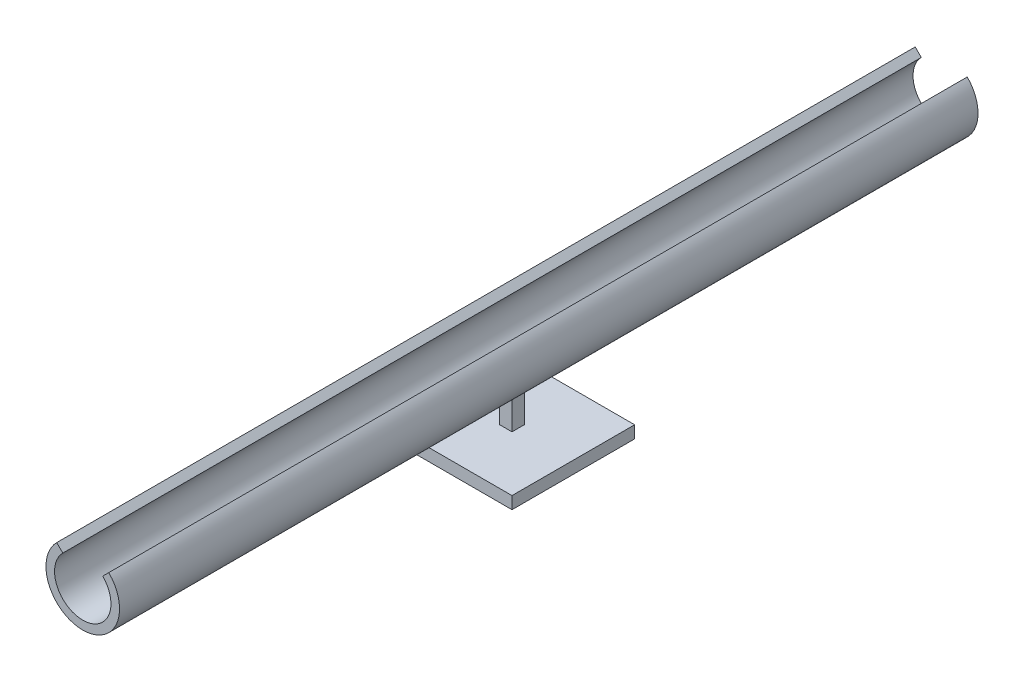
SolidWorks part; units mm, degrees
ref_plane "Plan de face" through (0, 0, 0) normal (0, 0, 1) x (1, 0, 0)
ref_plane "Plan de dessus" through (0, 0, 0) normal (0, 1, 0) x (1, 0, 0)
ref_plane "Plan de droite" through (0, 0, 0) normal (1, 0, 0) x (0, 0, -1)
sketch "Esquisse1" plane through (0, 0, 0) normal (0, 0, 1) x (1, 0, 0)
  line L0 (16.2635, 16.2635) -> (21.2132, 21.2132)
  line L1 (-16.2635, 16.2635) -> (-21.2132, 21.2132)
  line L2 (0, 0) -> (0, 79.2568) construction
  arc A0 (-16.2635, 16.2635) -> (16.2635, 16.2635) centre (0, 0) ccw
  arc A1 (-21.2132, 21.2132) -> (21.2132, 21.2132) centre (0, 0) ccw
  dimension "D1" = 23
  dimension "D2" = 30
extrude "Boss.-Extru.1" add sketch "Esquisse1" along normal mid plane 700
sketch "Esquisse2" plane through (0, 0, 0) normal (0, 0, 1) x (1, 0, 0)
  line L0 (0, 0) -> (0, -81.5006) construction
  line L1 (-5, -29.5804) -> (5, -29.5804)
  line L2 (-5, -29.5804) -> (-5, -60)
  line L3 (-5, -60) -> (5, -60)
  line L4 (5, -29.5804) -> (5, -60)
  arc A0 (-21.2132, 21.2132) -> (21.2132, 21.2132) centre (0, 0) ccw construction
  dimension "D1" = 10
  dimension "D2" = 60
extrude "Boss.-Extru.2" add sketch "Esquisse2" along normal mid plane 10
sketch "Esquisse3" plane through (0, 0, 0) normal (0, 0, 1) x (1, 0, 0)
  line L0 (-5, -60) -> (5, -60) construction
  line L1 (-50, -60) -> (50, -60)
  line L2 (-50, -60) -> (-50, -70)
  line L3 (-50, -70) -> (50, -70)
  line L4 (50, -60) -> (50, -70)
  line L5 (0, 0) -> (0, -80.461) construction
  dimension "D1" = 10
  dimension "D2" = 100
extrude "Boss.-Extru.3" add sketch "Esquisse3" along normal mid plane 100
